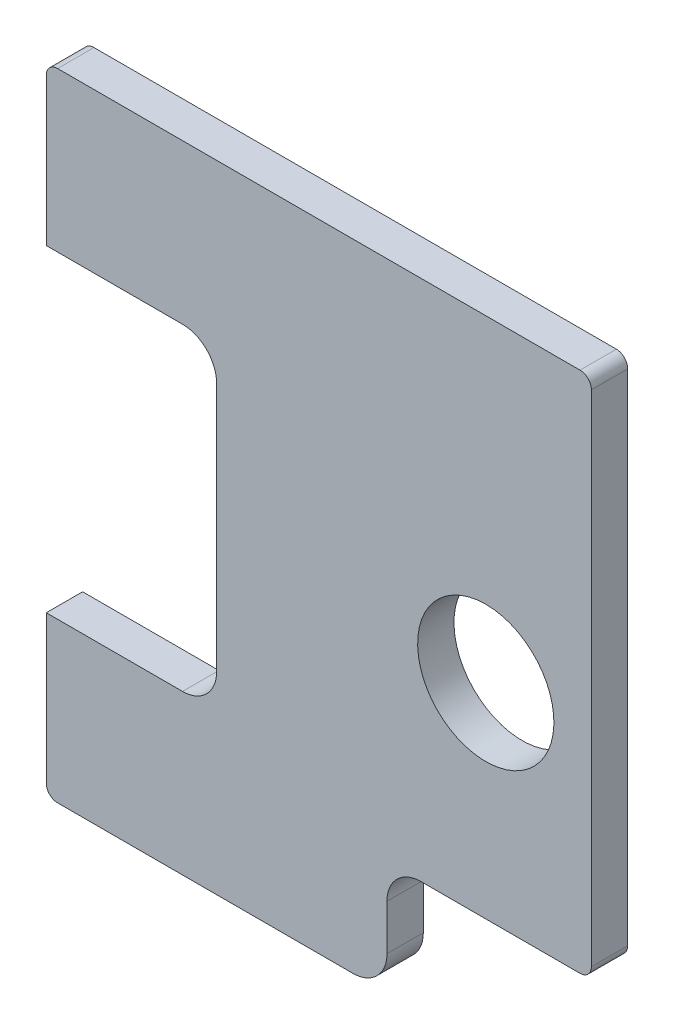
SolidWorks part; units mm, degrees
ref_plane "Plan1" through (0, 0, 0) normal (0, 0, 1) x (1, 0, 0)
ref_plane "Plan2" through (0, 0, 0) normal (0, 1, 0) x (1, 0, 0)
ref_plane "Plan3" through (0, 0, 0) normal (1, 0, 0) x (0, 0, -1)
sketch "Esquisse4" plane through (0, 0, -1.5) normal (0, 0, -1) x (-1, 0, 0)
  line L0 (31.3, -16.2542) -> (54.3, -16.2542)
  line L2 (54.8, -16.7542) -> (54.8, -23.2542)
  line L3 (54.8, -23.2542) -> (48.8, -23.2542)
  line L4 (47.3, -24.7542) -> (47.3, -35.7542)
  line L5 (48.8, -37.2542) -> (54.8, -37.2542)
  line L6 (54.8, -37.2542) -> (54.8, -43.7542)
  line L7 (54.3, -44.2542) -> (41.3, -44.2542)
  line L8 (39.8, -42.7542) -> (39.8, -40.7542)
  line L9 (38.3, -39.2542) -> (31.3, -39.2542)
  line L10 (30.8, -38.7542) -> (30.8, -16.7542)
  line L11 (40.95, -37.2542) -> (30.8, -37.2542) construction
  line L12 (40.95, -23.2542) -> (30.8, -23.2542) construction
  line L13 (40.95, -23.2542) -> (40.95, -37.2542) construction
  line L14 (30.8, 55.7512) -> (30.8, -55.7512) construction
  circle A0 centre (35.45, -30.2542) radius 3
  arc A1 (39.8, -40.7542) -> (38.3, -39.2542) centre (38.3, -40.7542) ccw
  arc A2 (41.3, -44.2542) -> (39.8, -42.7542) centre (41.3, -42.7542) cw
  arc A3 (47.3, -24.7542) -> (48.8, -23.2542) centre (48.8, -24.7542) cw
  arc A4 (48.8, -37.2542) -> (47.3, -35.7542) centre (48.8, -35.7542) cw
  arc A5 (54.3, -16.2542) -> (54.8, -16.7542) centre (54.3, -16.7542) cw
  arc A6 (30.8, -16.7542) -> (31.3, -16.2542) centre (31.3, -16.7542) cw
  arc A7 (31.3, -39.2542) -> (30.8, -38.7542) centre (31.3, -38.7542) cw
  arc A8 (54.8, -43.7542) -> (54.3, -44.2542) centre (54.3, -43.7542) cw
  circle A9 centre (35.45, -30.2542) radius 2 construction
  point P21 (39.8, -39.2542)
  point P24 (39.8, -44.2542)
  point P27 (47.3, -23.2542)
  point P32 (54.8, -16.2542)
  point P35 (30.8, -16.2542)
  point P38 (30.8, -39.2542)
  point P41 (54.8, -44.2542)
  dimension "D10" = 6
  dimension "D11" = 1.5
  dimension "D12" = 0.5
  dimension "D1" = 7
  dimension "D2" = 7
  dimension "D3" = 7
  dimension "D4" = 2
  dimension "D5" = 7
  dimension "D6" = 24
  dimension "D7" = 7.5
  dimension "D8" = 15
  dimension "D9" = 9
extrude "Base-Extrusion" add sketch "Esquisse4" along normal blind 1.6
